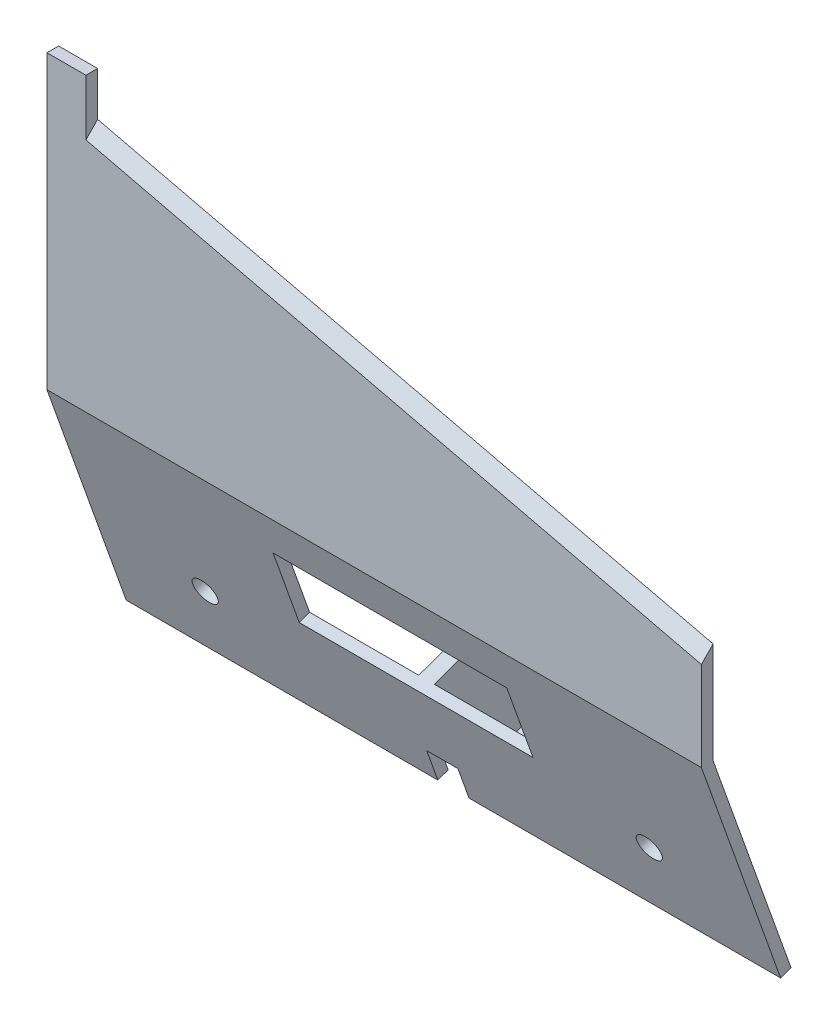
SolidWorks part; units mm, degrees
ref_plane "Face" through (0, 0, 0) normal (0, 0, 1) x (1, 0, 0)
ref_plane "Dessus" through (0, 0, 0) normal (0, 1, 0) x (1, 0, 0)
ref_plane "Droite" through (0, 0, 0) normal (1, 0, 0) x (0, 0, -1)
sketch "Esquisse1" plane through (0, 0, 0) normal (0, 0, 1) x (1, 0, 0)
  line L0 (0, 0) -> (0, 13)
  line L1 (0, 13) -> (-84, 33)
  line L2 (-84, 33) -> (-84, 0)
  line L3 (-84, 0) -> (0, 0)
  line L4 (-84, 33) -> (1.2169, 33) construction
  dimension "D1" = 33
  dimension "D2" = 20
  dimension "D3" = 84
extrude "Extrusion1" add sketch "Esquisse1" along normal blind 1.5
sketch "Esquisse2" plane through (0, 0, 0) normal (1, 0, 0) x (0, 0, -1)
  line L0 (0, 0) -> (10, -28)
  line L1 (-1.5, 0) -> (8.6697, -28.4751)
  line L2 (10, -28) -> (8.6697, -28.4751)
  line L3 (-1.5, 0) -> (0, 0)
  dimension "D1" = 28
  dimension "D2" = 10
extrude "Extrusion2" add sketch "Esquisse2" against normal blind 84
ref_plane "Plan1" through (-42, 0, 0) normal (1, 0, 0) x (0, 0, -1)
chamfer "Chanfrein1" distance 1.5 angle 45 1 edges at (-42, 23, 1.5)
sketch "Esquisse3" plane through (0, -0.4751, 1.3303) normal (0, -0.3363, 0.9417) x (1, 0, 0)
  line L1 (-27, -5.4955) -> (-57, -5.4955)
  line L2 (-27, -5.4955) -> (-27, -15.4955)
  line L3 (-27, -15.4955) -> (-57, -15.4955)
  line L4 (-57, -5.4955) -> (-57, -15.4955)
  line L5 (-84, 0.5045) -> (0, 0.5045) construction
  line L6 (-42, -50) -> (-42, 50) construction
  dimension "D1" = 15
  dimension "D2" = 30
  dimension "D3" = 6
  dimension "D4" = 10
extrude "Enlèv. mat.-Extru.1" cut sketch "Esquisse3" against normal through all
sketch "Esquisse5" plane through (-42, 0, 0) normal (1, 0, 0) x (0, 0, -1)
  line L0 (5.2117, -14.5928) -> (16.5126, -10.5567)
  line L1 (8.2387, -23.0684) -> (11.064, -22.0594)
  line L2 (10, -28) -> (0, 0) construction
  line L3 (16.5126, -10.5567) -> (22.2303, -26.5663)
  line L4 (11.064, -22.0594) -> (14.6964, -25.5405)
  line L5 (17.757, -24.4474) -> (14.6964, -25.5405)
  line L6 (22.2303, -26.5663) -> (17.5216, -28.248)
  line L7 (18.4297, -26.3309) -> (16.3108, -27.0877)
  line L8 (5.2117, -14.5928) -> (8.2387, -23.0684)
  line L9 (16.3108, -27.0877) -> (17.5216, -28.248)
  arc A0 (18.4297, -26.3309) -> (17.757, -24.4474) centre (18.0934, -25.3892) ccw
  dimension "D5" = 2
  dimension "D7" = 3.5
  dimension "D8" = 2.5
  dimension "D1" = 12
  dimension "D2" = 9
  dimension "D3" = 3
  dimension "D4" = 17
  dimension "D6" = 5
extrude "Extrusion4" add sketch "Esquisse5" along normal mid plane 2
ref_plane "Plan3" through (-40, 0, 0) normal (1, 0, 0) x (0, 0, -1)
sketch "Esquisse6" plane through (-40, 0, 0) normal (1, 0, 0) x (0, 0, -1)
  point P0 (18.0934, -25.3892)
ref_plane "Plan4" through (-40, 0, 0) normal (1, 0, 0) x (0, 0, -1)
sketch "Esquisse7" plane through (-40, 0, 0) normal (1, 0, 0) x (0, 0, -1)
  line L0 (0, 13) -> (0, 33) construction
  point P0 (0, 23)
sketch "Esquisse8" plane through (0, 0, 1.5) normal (0, 0, 1) x (1, 0, 0)
  line L0 (-84, 31.4581) -> (-84, 0) construction
  line L1 (-84, 27.5657) -> (-79, 27.5657)
  line L2 (-84, 27.5657) -> (-84, 37.4581)
  line L3 (-84, 37.4581) -> (-79, 37.4581)
  line L4 (-79, 27.5657) -> (-79, 37.4581)
  dimension "D1" = 5
  dimension "D2" = 6
extrude "Extrusion5" add sketch "Esquisse8" against normal blind 1.5
sketch "Esquisse9" plane through (0, -0.4751, 1.3303) normal (0, -0.3363, 0.9417) x (1, 0, 0)
  line L0 (-44, -25.4955) -> (-40, -25.4955)
  line L1 (-40, -29.9955) -> (-44, -29.9955)
  line L2 (-40, -29.9955) -> (-40, -25.4955)
  line L3 (-44, -18.7321) -> (-44, -26.7321) construction
  line L4 (-44, -29.9955) -> (-44, -25.4955)
  line L5 (-40, -26.7321) -> (-40, -18.7321) construction
  dimension "D1" = 4.5
extrude "Enlèv. mat.-Extru.2" cut sketch "Esquisse9" against normal up to next
sketch "Esquisse10" plane through (0, -0.4751, 1.3303) normal (0, -0.3363, 0.9417) x (1, 0, 0)
  circle A0 centre (-13.5, -19.7321) radius 1.6
  circle A1 centre (-70.5, -19.7321) radius 1.6
  dimension "D1" = 3.2
  dimension "D2" = 3.2
extrude "Enlèv. mat.-Extru.3" cut sketch "Esquisse10" against normal through all
